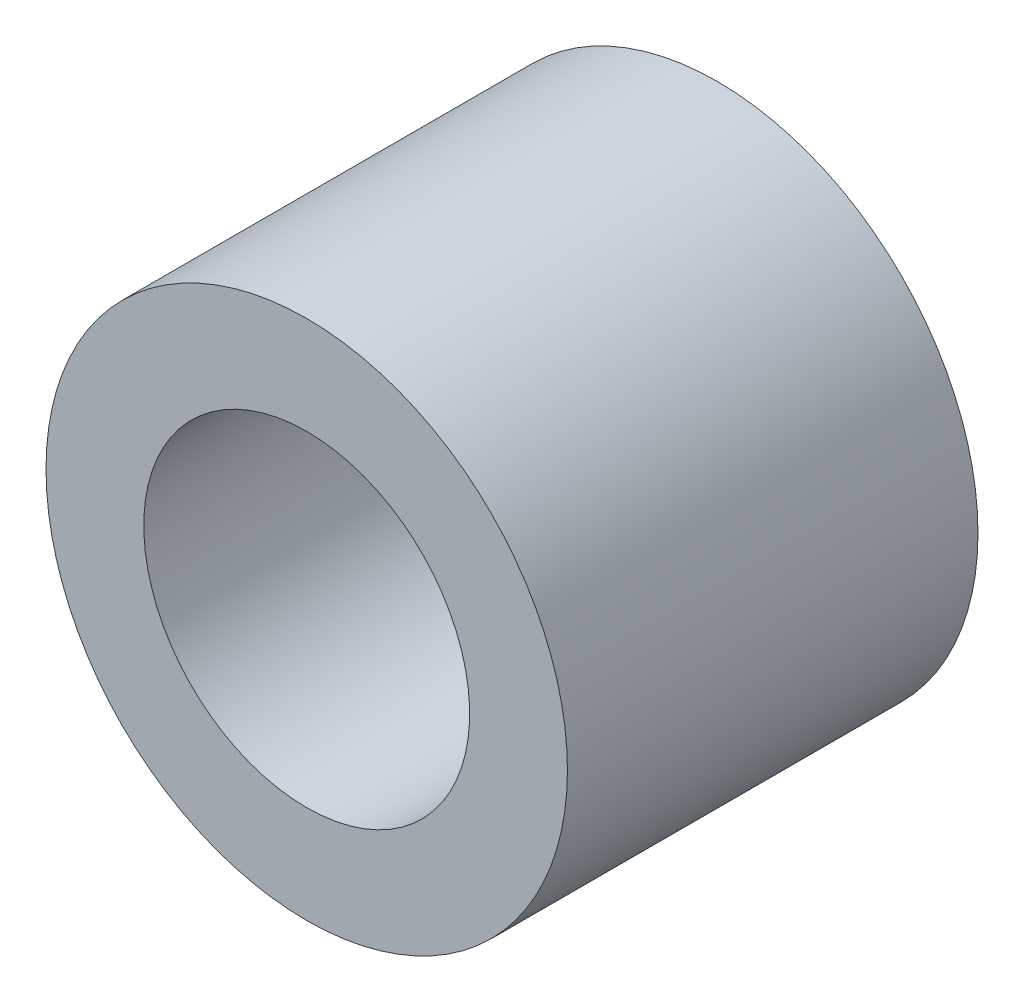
SolidWorks part; units mm, degrees
ref_plane "Front Plane" through (0, 0, 0) normal (0, 0, 1) x (1, 0, 0)
ref_plane "Top Plane" through (0, 0, 0) normal (0, 1, 0) x (1, 0, 0)
ref_plane "Right Plane" through (0, 0, 0) normal (1, 0, 0) x (0, 0, -1)
sketch "Sketch1" plane through (0, 0, 116.2215) normal (0, 0, -1) x (-1, 0, 0)
  circle A1 centre (0, 0) radius 2.54
  circle A3 centre (0, 0) radius 1.5875
  dimension "D1" = 3.175
  dimension "D2" = 5.08
extrude "Boss-Extrude1" add sketch "Sketch1" along normal blind 4 contours A1 A3
